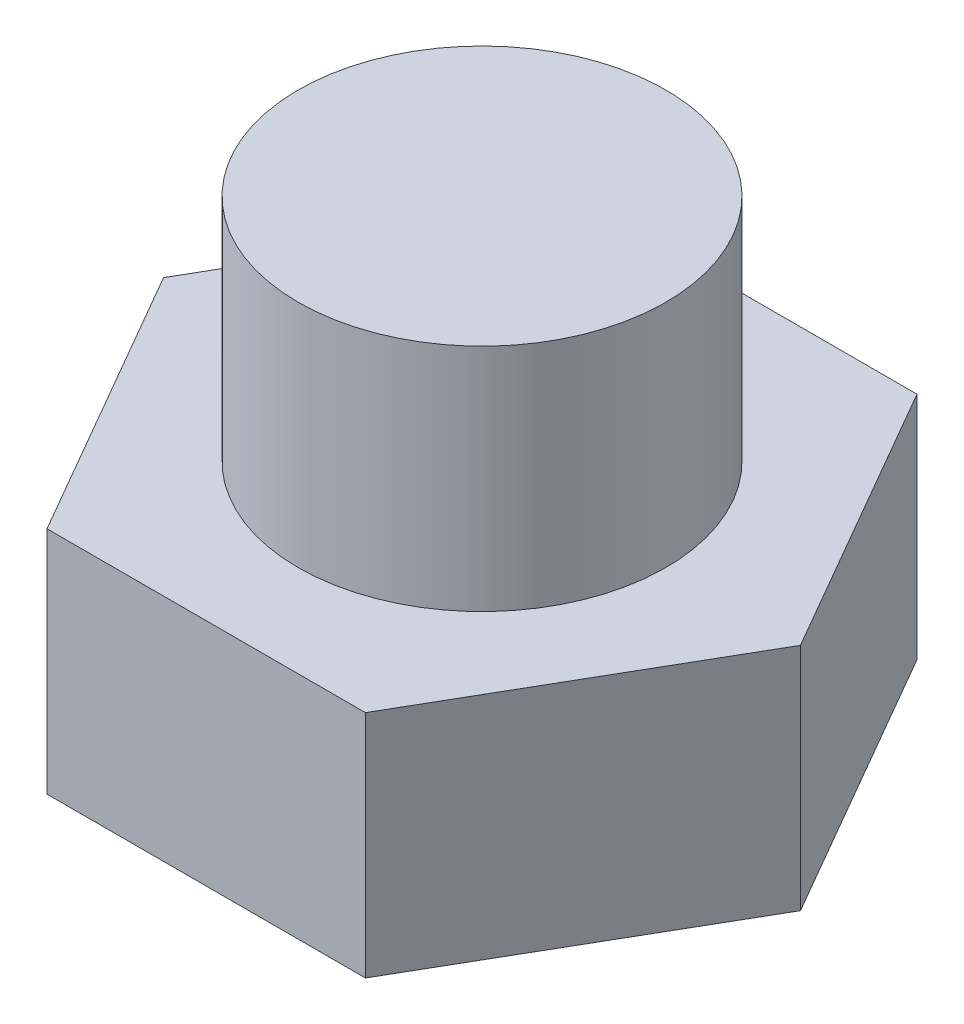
SolidWorks part; units mm, degrees
ref_plane "Front Plane" through (0, 0, 0) normal (0, 0, 1) x (1, 0, 0)
ref_plane "Top Plane" through (0, 0, 0) normal (0, 1, 0) x (1, 0, 0)
ref_plane "Right Plane" through (0, 0, 0) normal (1, 0, 0) x (0, 0, -1)
sketch "Sketch1" plane through (0, 0, 0) normal (0, 1, 0) x (1, 0, 0)
  line L1 (6.9282, 12) -> (-6.9282, 12)
  line L2 (-6.9282, 12) -> (-13.8564, 0)
  line L3 (-13.8564, 0) -> (-6.9282, -12)
  line L4 (-6.9282, -12) -> (6.9282, -12)
  line L5 (6.9282, -12) -> (13.8564, 0)
  line L6 (13.8564, 0) -> (6.9282, 12)
  circle A0 centre (0, 0) radius 12 construction
  dimension "D1" = 24
extrude "Boss-Extrude2" add sketch "Sketch1" along normal blind 10
sketch "Sketch3" plane through (0, 10, 0) normal (0, 1, 0) x (1, 0, 0)
  circle A0 centre (0, 0) radius 8
  dimension "D1" = 16
extrude "Boss-Extrude3" add sketch "Sketch3" along normal blind 10
